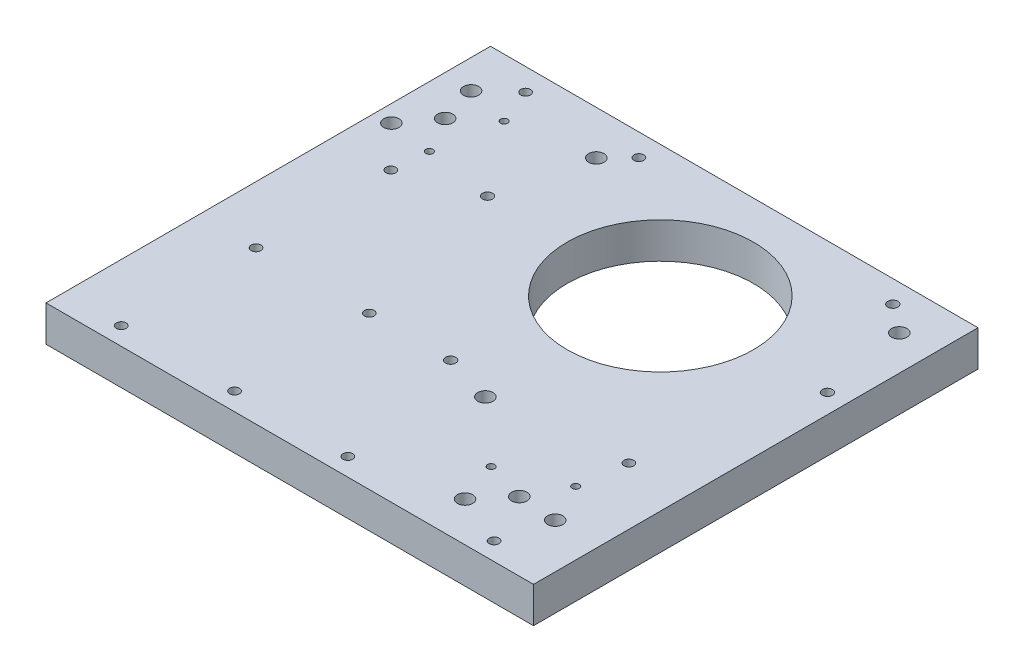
SolidWorks part; units mm, degrees
ref_plane "Front Plane" through (0, 0, 0) normal (0, 0, 1) x (1, 0, 0)
ref_plane "Top Plane" through (0, 0, 0) normal (0, 1, 0) x (1, 0, 0)
ref_plane "Right Plane" through (0, 0, 0) normal (1, 0, 0) x (0, 0, -1)
sketch "Sketch1" plane through (0, 0, 0) normal (0, 1, 0) x (1, 0, 0)
  line L1 (-107.95, 98.425) -> (107.95, 98.425)
  line L2 (-107.95, 98.425) -> (-107.95, -98.425)
  line L3 (-107.95, -98.425) -> (107.95, -98.425)
  line L4 (107.95, 98.425) -> (107.95, -98.425)
  line L5 (-107.95, 98.425) -> (107.95, -98.425) construction
  line L6 (-107.95, -98.425) -> (107.95, 98.425) construction
  circle A0 centre (25.4, 40.2844) radius 41.275
  point P0 (0, 0)
  dimension "D3" = 82.55
  dimension "D1" = 196.85
  dimension "D2" = 215.9
  dimension "D4" = 58.1406
  dimension "D5" = 82.55
extrude "Boss-Extrude1" add sketch "Sketch1" along normal blind 15.875
sketch "Sketch14" plane through (0, 0, 0) normal (0, -1, 0) x (1, 0, 0)
  circle A0 centre (25.4, -40.2844) radius 88.9 construction
  circle A1 centre (25.4, -40.2844) radius 63.5 construction
sketch "Sketch2" plane through (0, 15.875, 0) normal (0, 1, 0) x (1, 0, 0)
  line L0 (25.4, -47.6154) -> (25.4, 139.8191) construction
  line L1 (144.6235, 0) -> (-140.9397, 0) construction
  circle A0 centre (25.4, -37.1856) radius 3.3782
  circle A1 centre (-41.691, 79.0194) radius 3.3782
  circle A2 centre (92.491, 79.0194) radius 3.3782
  point P14 (25.4, 40.2844)
  dimension "D2" = 6.7564
  dimension "D3" = 77.47
  dimension "D1" = 3
extrude "Cut-Extrude1" cut sketch "Sketch2" against normal through all
sketch "Sketch6" plane through (0, 0, 0) normal (0, 1, 0) x (1, 0, 0)
  line L0 (17.78, -98.425) -> (17.78, 98.425) construction
  line L1 (-107.95, -98.425) -> (107.95, -98.425) construction
  line L2 (107.95, 98.425) -> (-107.95, 98.425) construction
  line L3 (-107.95, 98.425) -> (-107.95, -98.425) construction
  line L4 (-107.95, 98.425) -> (-107.95, -98.425) construction
  line L5 (107.95, -98.425) -> (107.95, 98.425) construction
  circle A0 centre (17.78, -90.4875) radius 1.905 construction
  circle A1 centre (50.165, -90.4875) radius 1.905 construction
  circle A2 centre (82.55, -90.4875) radius 1.905 construction
  circle A4 centre (82.55, -30.7975) radius 1.905 construction
  circle A5 centre (50.165, -19.672) radius 3.3093 construction
  circle A6 centre (82.55, 28.8925) radius 1.905 construction
  circle A9 centre (17.78, -30.7975) radius 1.905 construction
  circle A11 centre (17.78, 88.5825) radius 1.905 construction
  circle A12 centre (-32.385, -90.4875) radius 1.905 construction
  circle A13 centre (-82.55, -90.4875) radius 1.905 construction
  circle A14 centre (-32.385, -30.7975) radius 1.905 construction
  circle A15 centre (-82.55, -30.7975) radius 1.905 construction
  circle A16 centre (-32.385, 28.8925) radius 1.905 construction
  circle A17 centre (-82.55, 28.8925) radius 1.905 construction
  circle A18 centre (-32.385, 88.5825) radius 1.905 construction
  circle A19 centre (-82.55, 88.5825) radius 1.905 construction
  circle A20 centre (17.78, -30.7975) radius 1.905 construction
  circle A22 centre (17.78, 88.5825) radius 1.905 construction
  circle A23 centre (50.165, 28.8925) radius 1.905 construction
  circle A24 centre (82.55, 88.5825) radius 1.905 construction
  circle A25 centre (17.78, 28.8925) radius 1.905 construction
  circle A26 centre (17.78, 28.8925) radius 1.905 construction
  circle A27 centre (50.165, 88.5825) radius 1.905 construction
  circle A28 centre (50.165, -30.7975) radius 1.905 construction
  dimension "D1" = 7.9375
  dimension "D2" = 3.81
  dimension "D8" = 25.4
  dimension "D9" = 25.4
  dimension "D7" = 125.73
  dimension "D3" = 3
  dimension "D4" = 4
  dimension "D5" = 3
  dimension "D6" = 4
hole_wizard "CBORE for #8 Binding Head Machine Screw1" positions "Sketch7" profile "Sketch8" counterbore size "#8" standard "ANSI Inch"
sketch "Sketch7" plane through (0, 0, 0) normal (0, -1, 0) x (-1, 0, 0)
  point P0 (82.55, -90.4875)
  point P3 (32.385, -90.4875)
  point P6 (82.55, -30.7975)
  point P9 (82.55, 28.8925)
  point P12 (82.55, 88.5825)
  point P15 (32.385, 88.5825)
  point P21 (32.385, -30.7975)
  point P24 (-17.78, -90.4875)
  point P42 (-82.55, -90.4875)
  point P45 (-82.55, -30.7975)
sketch "Sketch8" plane through (-82.55, 0, 90.4875) normal (1, 0, 0) x (0, 0, -1)
  line L0 (0, 0) -> (0, 15.875)
  line L1 (0, 15.875) -> (2.1526, 15.875)
  line L3 (2.1526, 15.875) -> (2.1526, 4.4196)
  line L4 (2.1526, 4.4196) -> (3.9687, 4.4196)
  line L5 (3.9687, 4.4196) -> (3.9687, 0)
  line L7 (3.9687, 0) -> (0, 0)
  line L11 (0, -6.35) -> (0, 107.95) construction
  dimension "Thru Hole Dia." = 4.3053
  dimension "Thru Hole Depth" = 15.875
  dimension "C'Bore Dia." = 7.9375
  dimension "C'Bore Depth" = 4.4196
sketch "Sketch15" plane through (0, 0, 0) normal (0, -1, 0) x (1, 0, 0)
  line L0 (-89.4816, -22.5186) -> (0, -22.5186) construction
  line L1 (119.9253, -40.2844) -> (-118.0371, -40.2844) construction
sketch "Sketch16" plane through (0, 0, 0) normal (0, -1, 0) x (-1, 0, 0)
  line L0 (-119.9253, 40.2844) -> (118.0371, 40.2844) construction
  line L1 (36.3538, 88.5825) -> (-127.3617, 88.5825) construction
  circle A0 centre (-99.4011, 40.2844) radius 2.54 construction
  circle A1 centre (51.1102, 40.2844) radius 2.54
  circle A2 centre (-3.6212, -30.7975) radius 2.54
  circle A3 centre (32.385, 88.5825) radius 3.9687 construction
  circle A4 centre (32.385, 88.5825) radius 3.9687 construction
  circle A5 centre (-80.0666, 88.5825) radius 2.54
hole_wizard "CBORE for #8 Binding Head Machine Screw2" positions "Sketch17" profile "Sketch18" counterbore size "#8" standard "ANSI Inch"
sketch "Sketch17" plane through (0, 0, 0) normal (0, -1, 0) x (-1, 0, 0)
  point P0 (-99.4011, 40.2844)
  point P3 (-3.6212, -30.7975)
  point P6 (51.1102, 40.2844)
  point P9 (-80.0666, 88.5825)
sketch "Sketch18" plane through (99.4011, 0, -40.2844) normal (1, 0, 0) x (0, 0, -1)
  line L0 (0, 0) -> (0, 15.875)
  line L1 (0, 15.875) -> (2.2479, 15.875)
  line L3 (2.2479, 15.875) -> (2.2479, 4.4196)
  line L4 (2.2479, 4.4196) -> (3.9687, 4.4196)
  line L5 (3.9687, 4.4196) -> (3.9688, 0)
  line L7 (3.9688, 0) -> (0, 0)
  line L11 (0, -6.35) -> (0, 107.95) construction
  dimension "Thru Hole Dia." = 4.4958
  dimension "Thru Hole Depth" = 15.875
  dimension "C'Bore Dia." = 7.9375
  dimension "C'Bore Depth" = 4.4196
sketch "Sketch19" plane through (0, 0, 0) normal (0, -1, 0) x (1, 0, 0)
  circle A0 centre (88.1469, 69.0035) radius 3.3782
  circle A1 centre (71.1426, 67.9191) radius 3.3782
  circle A2 centre (60.0724, 80.8719) radius 3.3782
  dimension "D1" = 6.7564
  dimension "D2" = 6.7564
  dimension "D3" = 6.7564
extrude "Cut-Extrude2" cut sketch "Sketch19" against normal through all
sketch "Sketch20" plane through (0, 0, 0) normal (0, -1, 0) x (1, 0, 0)
  circle A0 centre (79.7098, 51.4919) radius 1.5875
  circle A1 centre (53.39, 62.6185) radius 1.5875
  dimension "D1" = 3.175
  dimension "D2" = 3.175
extrude "Cut-Extrude3" cut sketch "Sketch20" against normal through all
sketch "Sketch23" plane through (0, 0, 0) normal (0, -1, 0) x (-1, 0, 0)
  circle A0 centre (100.4393, 47.0079) radius 3.3782
  circle A1 centre (90.2886, 60.6932) radius 3.3782
  circle A2 centre (95.1465, 77.0249) radius 3.3782
  dimension "D1" = 6.7564
  dimension "D2" = 6.7564
  dimension "D3" = 6.7564
extrude "Cut-Extrude4" cut sketch "Sketch23" against normal through all
sketch "Sketch24" plane through (0, 0, 0) normal (0, -1, 0) x (-1, 0, 0)
  circle A0 centre (81.154, 44.5746) radius 1.5875
  circle A1 centre (76.1921, 72.7155) radius 1.5875
  dimension "D1" = 3.175
  dimension "D2" = 3.175
extrude "Cut-Extrude5" cut sketch "Sketch24" against normal through all
sketch "Sketch25" plane through (0, 0, -98.425) normal (0, 0, -1) x (-1, 0, 0)
  circle A0 centre (-57.5489, 7.9375) radius 3.3782
  circle A1 centre (2.7761, 7.9375) radius 3.3782
  dimension "D1" = 6.7564
  dimension "D2" = 6.7564
extrude "Cut-Extrude6" cut sketch "Sketch25" against normal blind 19.05
sketch "Sketch26" plane through (0, 0, -98.425) normal (0, 0, -1) x (-1, 0, 0)
  circle A0 centre (-43.2614, 7.9375) radius 1.5875
  circle A1 centre (-11.5114, 7.9375) radius 1.5875
  dimension "D1" = 3.175
  dimension "D2" = 3.175
extrude "Cut-Extrude7" cut sketch "Sketch26" against normal blind 6.35
